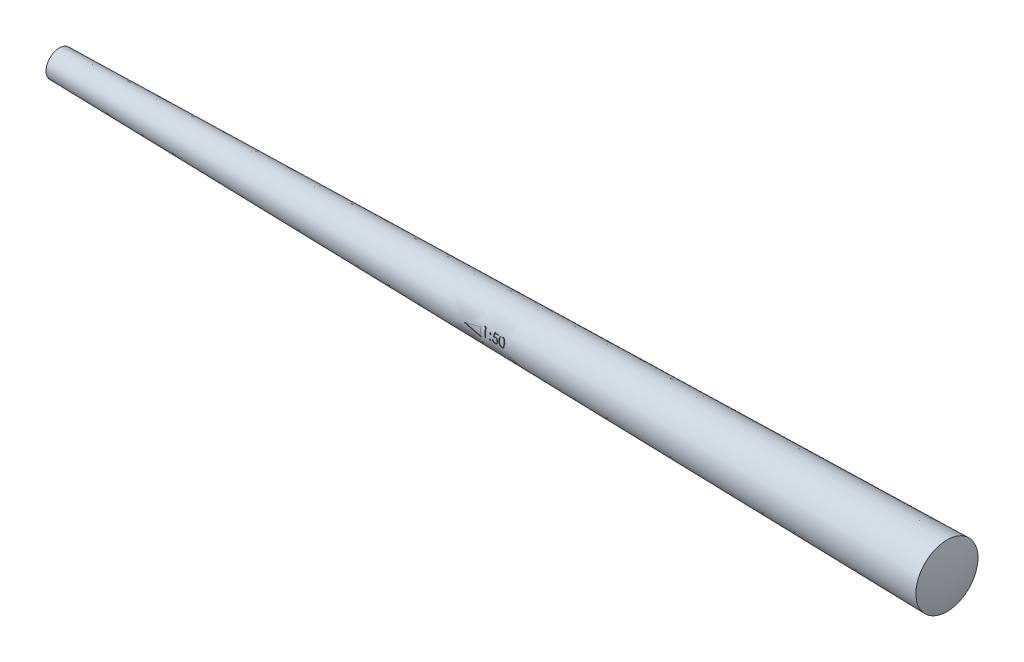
SolidWorks part; units mm, degrees
ref_plane "Front Plane" through (0, 0, 0) normal (0, 0, 1) x (1, 0, 0)
ref_plane "Top Plane" through (0, 0, 0) normal (0, 1, 0) x (1, 0, 0)
ref_plane "Right Plane" through (0, 0, 0) normal (1, 0, 0) x (0, 0, -1)
sketch "Sketch1" plane through (0, 0, 0) normal (1, 0, 0) x (0, 0, -1)
  circle A0 centre (0, 0) radius 1.5
  dimension "D1" = 3
extrude "Extrude1" add sketch "Sketch1" along normal mid plane 100
draft "Draft1" type of draft neutral plane draft angle 1.146 faces to draft 1 parameters "D1"=1.146
sketch "Sketch2" plane through (0, 0, 0) normal (0, 0, 1) x (1, 0, 0)
  line L0 (-50, 0) -> (-50, 1.5)
  line L1 (-50, 1.5) -> (-50, -1.5) construction
  line L2 (-50, 0) -> (-50.45, 0)
  line L3 (-50.45, 0) -> (-50.45, -2.5) construction
  line L4 (50, 0) -> (50, 3.5001)
  line L5 (50, -3.5001) -> (50, 3.5001) construction
  line L6 (50, 0) -> (50.45, 0)
  line L7 (50.45, 0) -> (50.45, -2.5) construction
  line L8 (-50, -1.5) -> (50, -3.5001) construction
  arc A0 (-50.45, 0) -> (-50, 1.5) centre (-47.725, 0) cw
  arc A1 (50.45, 0) -> (50, 3.5001) centre (36.6134, 0) ccw
  point P14 (0, -2.5)
revolve "Revolve1" add sketch "Sketch2" angle 360 about L2
sketch "Sketch5" plane through (0, 0, 0) normal (0, 0, 1) x (1, 0, 0)
  line L0 (0, 2.5) -> (0, -2.5) construction
  line L1 (50, 3.5001) -> (-50, 1.5) construction
  line L2 (-50, -1.5) -> (50, -3.5001) construction
ref_plane "Plane2" through (0, 0, 0) normal (-0.02, 0, 0.9998) x (0.9998, 0, 0.02)
sketch "Sketch6" plane through (0, 0, 0) normal (-0.02, 0, 0.9998) x (0.9998, 0, 0.02)
  line L0 (0, 0) -> (0, 0.5)
  line L1 (0, 2.5) -> (0, -2.5) construction
  line L2 (0, 0.5) -> (-1.866, 0)
  line L3 (-1.866, 0) -> (0, -0.5)
  line L4 (0, -0.5) -> (0, 0)
  line L5 (0, -0.25) -> (3, -0.25) construction
  text T0 "1:50" font "Century Gothic" height 1
  dimension "D1" = 1
  dimension "D2" = 30
  dimension "D3" = 3
wrap "Wrap2" sketch "Sketch6" wrap type deboss source sketch "Sketch6" thickness 0.05 parameters "D1"=0.05
equation "\"D2@Sketch2\" = \"D1@Sketch2\""
